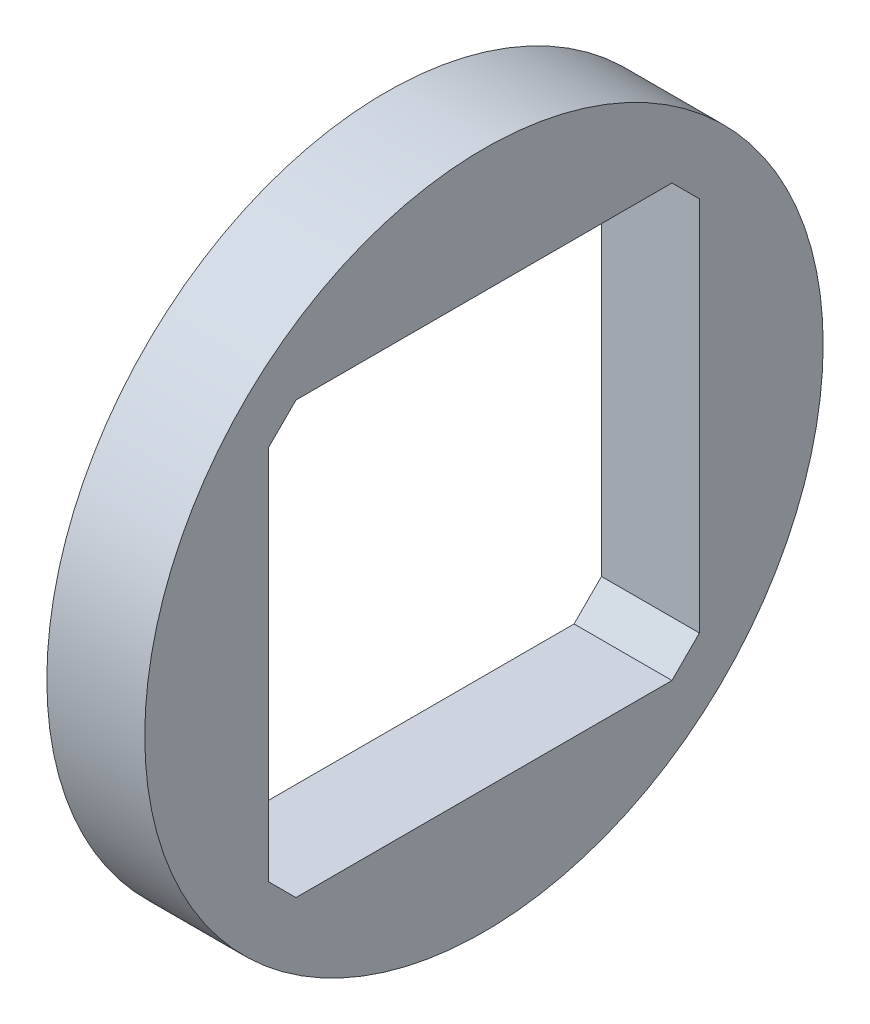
SolidWorks part; units mm, degrees
ref_plane "Front Plane" through (0, 0, 0) normal (0, 0, 1) x (1, 0, 0)
ref_plane "Top Plane" through (0, 0, 0) normal (0, 1, 0) x (1, 0, 0)
ref_plane "Right Plane" through (0, 0, 0) normal (1, 0, 0) x (0, 0, -1)
sketch "Sketch1" plane through (0, 0, 0) normal (1, 0, 0) x (0, 0, -1)
  circle A1 centre (0, 0) radius 21.997
  dimension "D1" = 43.9941
extrude "Boss-Extrude1" add sketch "Sketch1" along normal blind 6.35
sketch "Sketch3" plane through (0, 0, 0) normal (-1, 0, 0) x (0, 0, 1)
  line L0 (-13.97, 12.192) -> (-12.192, 13.97)
  line L1 (13.97, -13.97) -> (-13.97, -13.97)
  line L2 (13.97, -13.97) -> (13.97, 13.97)
  line L3 (13.97, 13.97) -> (-13.97, 13.97)
  line L4 (-13.97, -13.97) -> (-13.97, 13.97)
  line L5 (12.192, 13.97) -> (13.97, 12.192)
  line L6 (-13.97, -12.192) -> (-12.192, -13.97)
  line L7 (12.192, -13.97) -> (13.97, -12.192)
  dimension "D1" = 27.94
  dimension "D2" = 27.94
  dimension "D3" = 13.97
  dimension "D4" = 13.97
  dimension "D5" = 1.778
  dimension "D6" = 1.778
  dimension "D7" = 1.778
  dimension "D8" = 1.778
  dimension "D9" = 1.778
  dimension "D10" = 1.778
  dimension "D11" = 1.778
  dimension "D12" = 1.778
extrude "Cut-Extrude1" cut sketch "Sketch3" against normal blind 6.35 contours L1 L7 L2 L5 L3 L0 L4 L6
